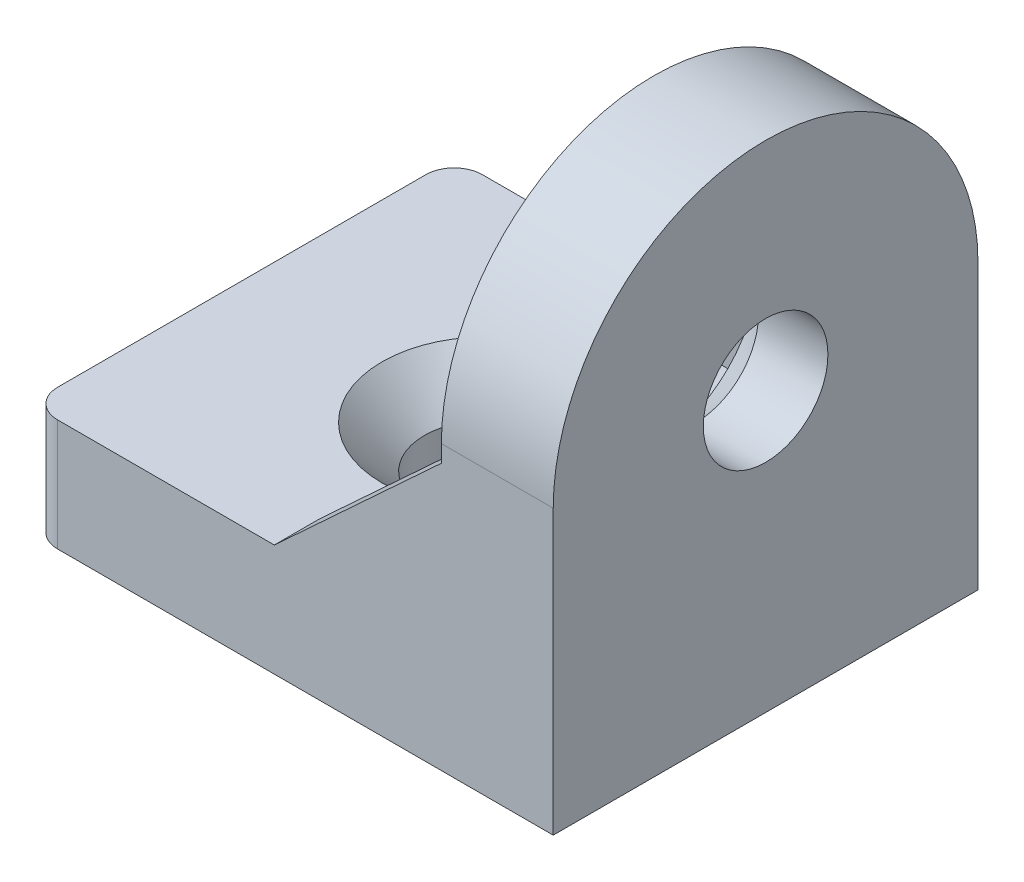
SolidWorks part; units mm, degrees
ref_plane "Plan de face" through (0, 0, 0) normal (0, 0, 1) x (1, 0, 0)
ref_plane "Plan de dessus" through (0, 0, 0) normal (0, 1, 0) x (1, 0, 0)
ref_plane "Plan de droite" through (0, 0, 0) normal (1, 0, 0) x (0, 0, -1)
sketch "Esquisse1" plane through (0, 0, 0) normal (0, 0, 1) x (1, 0, 0)
  line L0 (29.1, 35) -> (29.1, 18.8)
  line L1 (0, 0) -> (37, 0)
  line L2 (29.1, 35) -> (37, 35)
  line L3 (0, 7.9) -> (0, 0)
  line L4 (37, 0) -> (37, 35)
  line L5 (17.3, 7.9) -> (0, 7.9)
  line L6 (17.3, 7.9) -> (29.1, 18.8)
  dimension "D1" = 37
  dimension "D2" = 35
  dimension "D3" = 7.9
  dimension "D4" = 7.9
  dimension "D5" = 17.3
  dimension "D6" = 16.2
extrude "Extrusion1" add sketch "Esquisse1" along normal blind 30
sketch "Esquisse2" plane through (29.1, 0, 0) normal (-1, 0, 0) x (0, 0, 1)
  line L0 (0, 35) -> (0, 18.8) construction
  line L1 (30, 35) -> (30, 18.8) construction
  line L2 (-1.7575, 20) -> (32.2339, 20) construction
  line L3 (15, 35) -> (15, 7.9) construction
  line L4 (30, 35) -> (0, 35) construction
  line L5 (30, 7.9) -> (0, 7.9) construction
  arc A0 (0, 20) -> (30, 20) centre (15, 20) cw
  dimension "D1" = 15
extrude "Extrusion2" cut sketch "Esquisse2" against normal blind 30
sketch "Esquisse3" plane through (29.1, 0, 0) normal (-1, 0, 0) x (0, 0, 1)
  line L0 (30, 7.9) -> (0, 7.9) construction
  line L1 (3.2, 7.9) -> (26.8, 7.9)
  line L2 (3.2, 7.9) -> (3.2, 18.8)
  line L3 (3.2, 18.8) -> (26.8, 18.8)
  line L4 (26.8, 7.9) -> (26.8, 18.8)
  line L5 (30, 18.8) -> (0, 18.8) construction
  line L6 (0, 18.8) -> (0, 7.9) construction
  line L7 (30, 18.8) -> (30, 7.9) construction
  dimension "D1" = 3.2
  dimension "D2" = 3.2
extrude "Extrusion3" cut sketch "Esquisse3" along normal blind 17
sketch "Esquisse4" plane through (29.1, 0, 0) normal (-1, 0, 0) x (0, 0, 1)
  line L0 (30, 18.8) -> (30, 7.9) construction
  line L1 (30, 0) -> (0, 0) construction
  circle A0 centre (15, 19.7) radius 4.4
  dimension "D1" = 8.8
  dimension "D3" = 15
  dimension "D4" = 19.7
extrude "Extrusion4" cut sketch "Esquisse4" against normal blind 17
chamfer "Chanfrein1" distance 3 angle 45 1 edges at (29.1, 15.3, 15)
sketch "Esquisse6" plane through (0, 7.9, 0) normal (0, 1, 0) x (1, 0, 0)
  line L0 (0, -30) -> (0, 0) construction
  line L2 (17.3, -30) -> (0, -30) construction
  circle A0 centre (17.3, -15) radius 4.4
  dimension "D1" = 8.8
  dimension "D3" = 15
  dimension "D2" = 17.3
extrude "Extrusion5" cut sketch "Esquisse6" against normal blind 17
chamfer "Chanfrein2" distance 3 angle 45 1 edges at (12.9, 7.9, 15)
fillet "Congé1" radius 2 2 edges at (0, 3.95, 30) (0, 3.95, 0)
